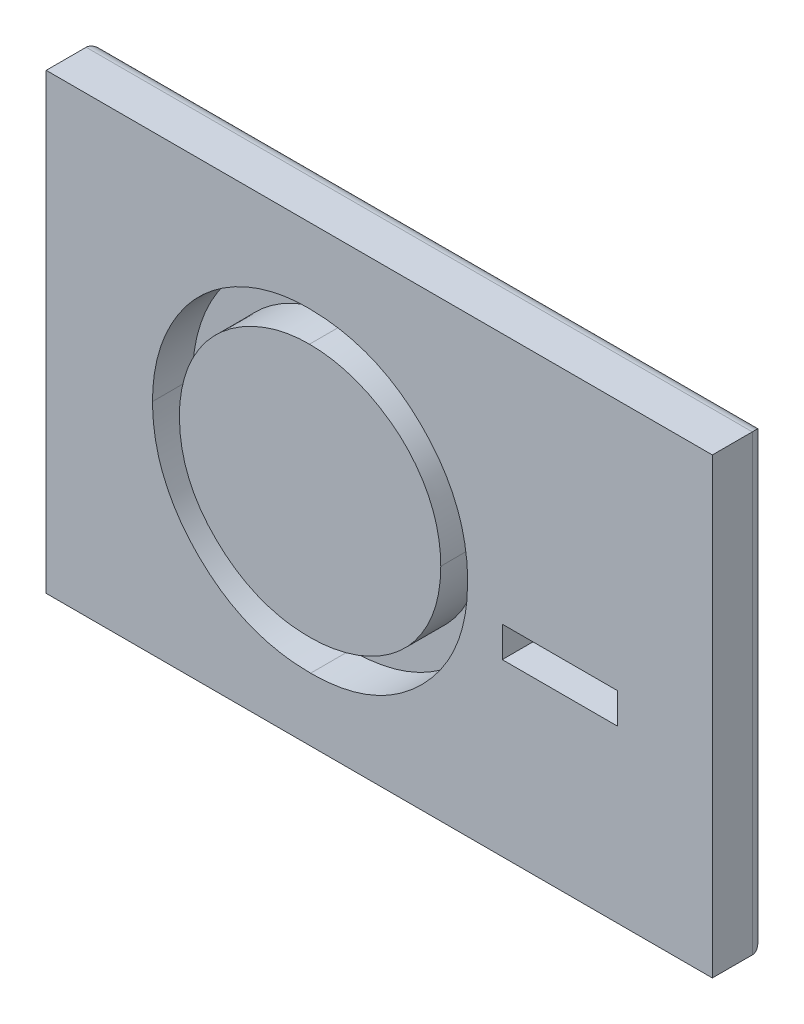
SolidWorks part; units mm, degrees
ref_plane "Front Plane" through (0, 0, 0) normal (0, 0, 1) x (1, 0, 0)
ref_plane "Top Plane" through (0, 0, 0) normal (0, 1, 0) x (1, 0, 0)
ref_plane "Right Plane" through (0, 0, 0) normal (1, 0, 0) x (0, 0, -1)
sketch "Sketch1" plane through (0, 0, 0) normal (0, 0, 1) x (1, 0, 0)
  line L1 (-15.875, -10.795) -> (15.875, -10.795)
  line L2 (-15.875, -10.795) -> (-15.875, 10.795)
  line L3 (-15.875, 10.795) -> (15.875, 10.795)
  line L4 (15.875, -10.795) -> (15.875, 10.795)
  line L5 (-15.875, -10.795) -> (15.875, 10.795) construction
  line L6 (-15.875, 10.795) -> (15.875, -10.795) construction
  point P0 (0, 0)
  dimension "D1" = 31.75
  dimension "D2" = 21.59
extrude "Boss-Extrude1" add sketch "Sketch1" along normal blind 2.54
fillet "Fillet1" radius 0.635 4 edges at (-15.875, 0, 0) (0, -10.795, 0) (0, 10.795, 0) (15.875, 0, 0)
sketch "Sketch2" plane through (0, 0, 2.54) normal (0, 0, 1) x (1, 0, 0)
  line L0 (-15.875, 10.795) -> (-14.977, 9.897) construction
  line L2 (-14.977, 9.897) -> (-14.977, 4.9485) construction
  line L3 (-14.977, 4.9485) -> (-14.977, 0) construction
  line L4 (-14.977, 0) -> (-14.977, -4.9485) construction
  line L5 (-14.977, -4.9485) -> (-14.977, -9.897) construction
  line L6 (-14.977, -9.897) -> (-15.875, -10.795) construction
  line L7 (15.875, 10.795) -> (-15.875, 10.795) construction
  line L8 (-15.875, -10.795) -> (15.875, -10.795) construction
  line L9 (-14.977, 4.9485) -> (14.977, 4.9485) construction
  line L10 (14.977, 4.9485) -> (14.977, 0) construction
  line L11 (14.977, 0) -> (-14.977, 0) construction
  line L12 (14.977, 0) -> (14.977, -4.9485) construction
  line L13 (14.977, -4.9485) -> (-14.977, -4.9485) construction
  line L14 (-14.977, -9.897) -> (14.977, -9.897) construction
  line L15 (14.977, -9.897) -> (14.977, -4.9485) construction
  line L16 (-14.977, 9.897) -> (14.977, 9.897) construction
  line L17 (14.977, 9.897) -> (14.977, 4.9485) construction
  line L18 (14.977, 9.897) -> (15.875, 10.795) construction
  line L19 (14.977, -9.897) -> (15.875, -10.795) construction
  line L20 (-14.977, -7.4227) -> (14.977, -7.4227) construction
  text T0 "O-" font "Century Gothic" height 14.2875
  dimension "D1" = 45
  dimension "D2" = 45
  dimension "D3" = 1.27
extrude "Cut-Extrude1" cut sketch "Sketch2" against normal blind 1.905
